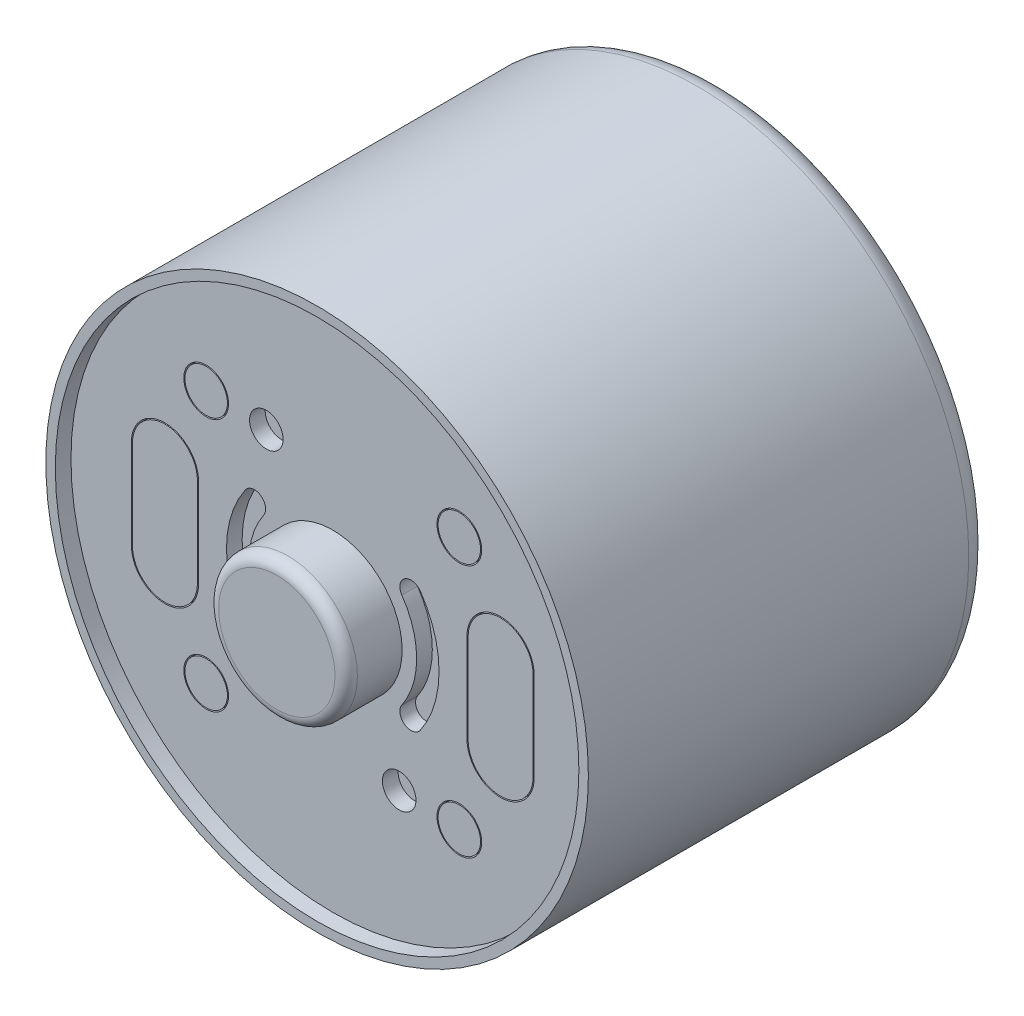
SolidWorks part; units mm, degrees
ref_plane "Plan de face" through (0, 0, 0) normal (0, 0, 1) x (1, 0, 0)
ref_plane "Plan de dessus" through (0, 0, 0) normal (0, 1, 0) x (1, 0, 0)
ref_plane "Plan de droite" through (0, 0, 0) normal (1, 0, 0) x (0, 0, -1)
sketch "Esquisse1" plane through (0, 0, 0) normal (0, 0, 1) x (1, 0, 0)
  circle A0 centre (0, 0) radius 12.125
  dimension "D1" = 24.25
extrude "Extrusion1" add sketch "Esquisse1" against normal blind 18
sketch "Esquisse2" plane through (0, 0, -18) normal (0, 0, -1) x (-1, 0, 0)
  circle A0 centre (0, 0) radius 1
  dimension "D1" = 2
extrude "Extrusion2" add sketch "Esquisse2" along normal blind 7
fillet "Congé1" radius 1 1 edges at (12.125, 0, -18)
fillet "Congé2" radius 0.2 1 edges at (-1, 0, -25)
sketch "Esquisse3" plane through (0, 0, -18) normal (0, 0, -1) x (-1, 0, 0)
  circle A0 centre (0, 0) radius 3.25
  dimension "D1" = 6.5
extrude "Extrusion3" add sketch "Esquisse3" along normal blind 0.5
sketch "Esquisse4" plane through (0, 0, -18.5) normal (0, 0, -1) x (-1, 0, 0)
  circle A0 centre (0, 0) radius 2.5
  circle A1 centre (0, 0) radius 2.45
  dimension "D1" = 5
  dimension "D2" = 0.05
extrude "Enlèv. mat.-Extru.1" cut sketch "Esquisse4" against normal blind 0.1
sketch "Esquisse5" plane through (0, 0, 0) normal (0, 0, 1) x (1, 0, 0)
  circle A0 centre (0, 0) radius 11.7
  dimension "D1" = 23.4
extrude "Enlèv. mat.-Extru.2" cut sketch "Esquisse5" against normal blind 0.7
sketch "Esquisse6" plane through (0, 0, -0.7) normal (0, 0, 1) x (1, 0, 0)
  line L0 (-3.5, 2.4109) -> (3.5, 2.4109) construction
  line L1 (0, 0) -> (0, 2.4109) construction
  line L2 (0, 0) -> (0, -2.4109) construction
  line L3 (-3.5, -2.4109) -> (3.5, -2.4109) construction
  line L4 (-9, 2) -> (-9, -2)
  line L5 (6, 2) -> (6, -2)
  line L6 (-6, 2) -> (-6, -2)
  line L7 (9, 2) -> (9, -2)
  line L8 (-7.5, -2) -> (-7.5, 2) construction
  line L9 (-7.5, 2) -> (-7.5, 0) construction
  line L10 (-7.5, 0) -> (0, 0) construction
  line L11 (-8.95, 2) -> (-8.95, -2)
  line L12 (-6.05, 2) -> (-6.05, -2)
  line L13 (6.05, 2) -> (6.05, -2)
  line L14 (8.95, 2) -> (8.95, -2)
  line L15 (0, 0) -> (-2.9686, 5.5) construction
  line L16 (0, 0) -> (2.9686, -5.5) construction
  line L17 (0, 0) -> (-5.6569, 5.6569) construction
  line L18 (0, 0) -> (5.6569, -5.6569) construction
  line L19 (0, 0) -> (-5.6569, -5.6569) construction
  line L20 (0, 0) -> (5.6569, 5.6569) construction
  arc A0 (3.9118, -2.6945) -> (3.9118, 2.6945) centre (0, 0) ccw
  arc A1 (3.0882, -2.1273) -> (3.0882, 2.1273) centre (0, 0) ccw
  circle A2 centre (0, 0) radius 4.25 construction
  arc A3 (-3.0882, 2.1273) -> (-3.9118, 2.6945) centre (-3.5, 2.4109) ccw
  arc A4 (-3.9118, -2.6945) -> (-3.0882, -2.1273) centre (-3.5, -2.4109) ccw
  arc A5 (3.0882, -2.1273) -> (3.9118, -2.6945) centre (3.5, -2.4109) ccw
  arc A6 (3.9118, 2.6945) -> (3.0882, 2.1273) centre (3.5, 2.4109) ccw
  arc A7 (-3.0882, 2.1273) -> (-3.0882, -2.1273) centre (0, 0) ccw
  arc A8 (-3.9118, 2.6945) -> (-3.9118, -2.6945) centre (0, 0) ccw
  arc A9 (-6, 2) -> (-9, 2) centre (-7.5, 2) ccw
  arc A10 (-9, -2) -> (-6, -2) centre (-7.5, -2) ccw
  arc A11 (9, -2) -> (6, -2) centre (7.5, -2) cw
  arc A12 (6, 2) -> (9, 2) centre (7.5, 2) cw
  arc A13 (-8.95, -2) -> (-6.05, -2) centre (-7.5, -2) ccw
  arc A14 (-6.05, 2) -> (-8.95, 2) centre (-7.5, 2) ccw
  arc A15 (8.95, -2) -> (6.05, -2) centre (7.5, -2) cw
  arc A16 (6.05, 2) -> (8.95, 2) centre (7.5, 2) cw
  circle A17 centre (0, 0) radius 6.25 construction
  circle A18 centre (-2.9686, 5.5) radius 0.75
  circle A19 centre (2.9686, -5.5) radius 0.75
  circle A20 centre (0, 0) radius 8 construction
  circle A21 centre (-5.6569, 5.6569) radius 1
  circle A22 centre (-5.6569, -5.6569) radius 1
  circle A23 centre (5.6569, -5.6569) radius 1
  circle A24 centre (5.6569, 5.6569) radius 1
  circle A25 centre (-5.6569, 5.6569) radius 0.95
  circle A26 centre (-5.6569, -5.6569) radius 0.95
  circle A27 centre (5.6569, -5.6569) radius 0.95
  circle A28 centre (5.6569, 5.6569) radius 0.95
  dimension "D1" = 7.5
  dimension "D2" = 9.5
  dimension "D4" = 8.5
  dimension "D9" = 12.5
  dimension "D11" = 1.5
  dimension "D12" = 16
  dimension "D16" = 2
  dimension "D3" = 7
  dimension "D5" = 3
  dimension "D6" = 12
  dimension "D7" = 4
  dimension "D10" = 11
  dimension "D13" = 45
  dimension "D14" = 45
  dimension "D8" = 0.05
  dimension "D15" = 0.05
extrude "Enlèv. mat.-Extru.3" cut sketch "Esquisse6" against normal blind 0.7
sketch "Esquisse7" plane through (0, 0, -0.7) normal (0, 0, 1) x (1, 0, 0)
  circle A0 centre (0, 0) radius 3.1
  dimension "D1" = 6.2
extrude "Extrusion4" add sketch "Esquisse7" along normal blind 2.5
fillet "Congé3" radius 0.5 1 edges at (3.1, 0, 1.8)
